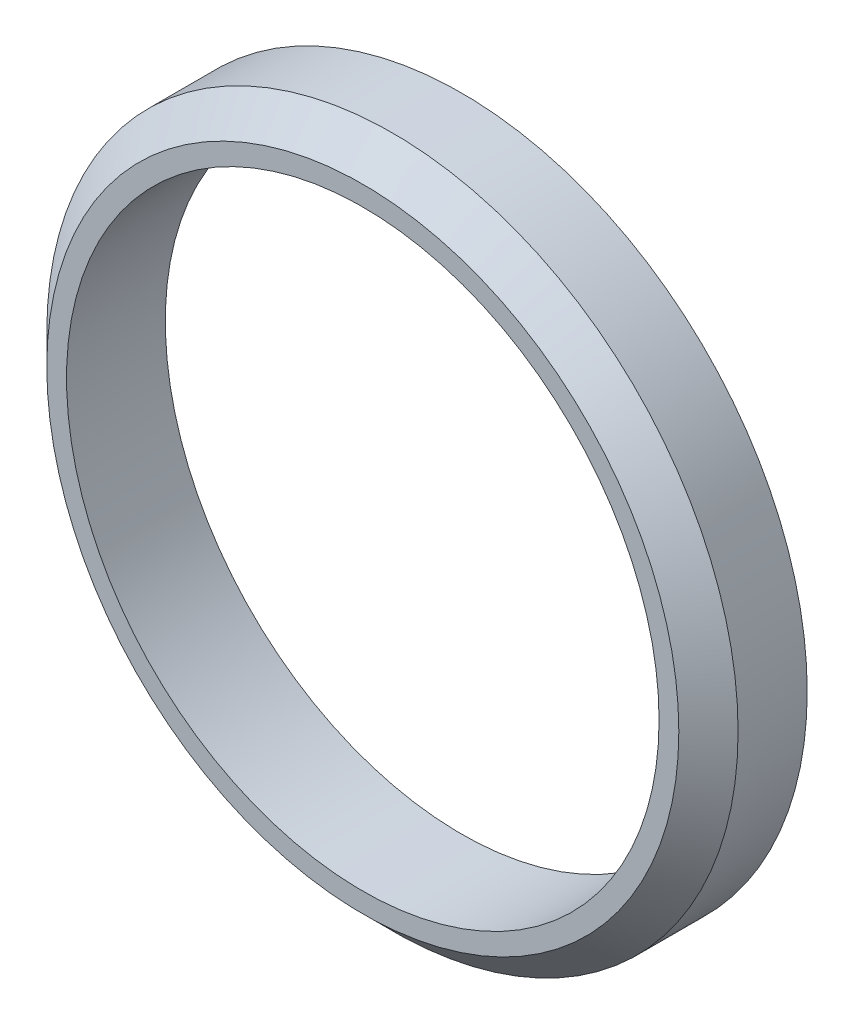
SolidWorks part; units mm, degrees
ref_plane "Спереди" through (0, 0, 0) normal (0, 0, 1) x (1, 0, 0)
ref_plane "Сверху" through (0, 0, 0) normal (0, 1, 0) x (1, 0, 0)
ref_plane "Справа" through (0, 0, 0) normal (1, 0, 0) x (0, 0, -1)
sketch "Эскиз1" plane through (0, 0, 0) normal (0, 0, 1) x (1, 0, 0)
  circle A0 centre (0, 0) radius 30
  circle A1 centre (0, 0) radius 35
extrude "Бобышка-Вытянуть1" add sketch "Эскиз1" along normal blind 10
chamfer "Фаска1" distance 3 angle 45 1 edges at (35, 0, 10)
